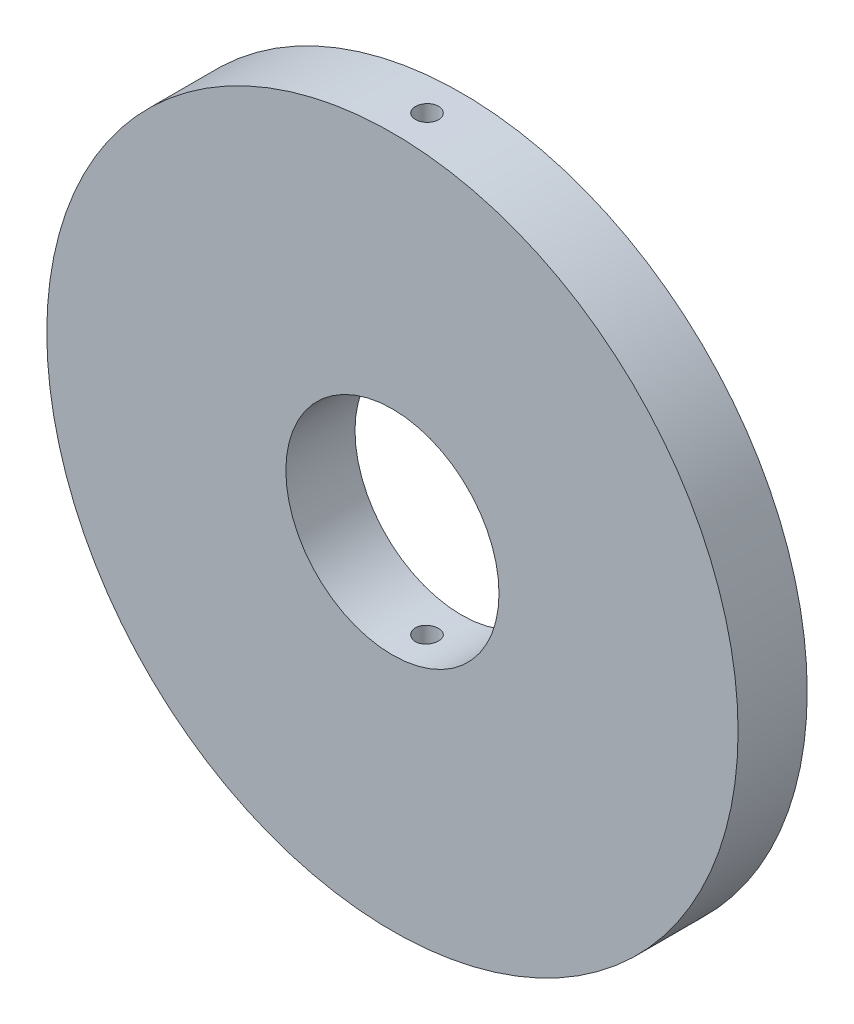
SolidWorks part; units mm, degrees
ref_plane "Front Plane" through (0, 0, 0) normal (0, 0, 1) x (1, 0, 0)
ref_plane "Top Plane" through (0, 0, 0) normal (0, 1, 0) x (1, 0, 0)
ref_plane "Right Plane" through (0, 0, 0) normal (1, 0, 0) x (0, 0, -1)
sketch "Sketch1" plane through (0, 0, 0) normal (0, 0, 1) x (1, 0, 0)
  circle A0 centre (0, 0) radius 60
  circle A1 centre (0, 0) radius 18.5
  dimension "D1" = 120
  dimension "D2" = 37
extrude "Boss-Extrude1" add sketch "Sketch1" along normal mid plane 12
sketch "Sketch2" plane through (0, 0, 0) normal (0, 1, 0) x (1, 0, 0)
  circle A0 centre (0, 0) radius 2
  dimension "D1" = 4
extrude "Cut-Extrude1" cut sketch "Sketch2" against normal through all both and the other way through all
sketch "Sketch3" plane through (0, 0, 0) normal (0, 0, 1) x (1, 0, 0)
  point P0 (0, 0)
